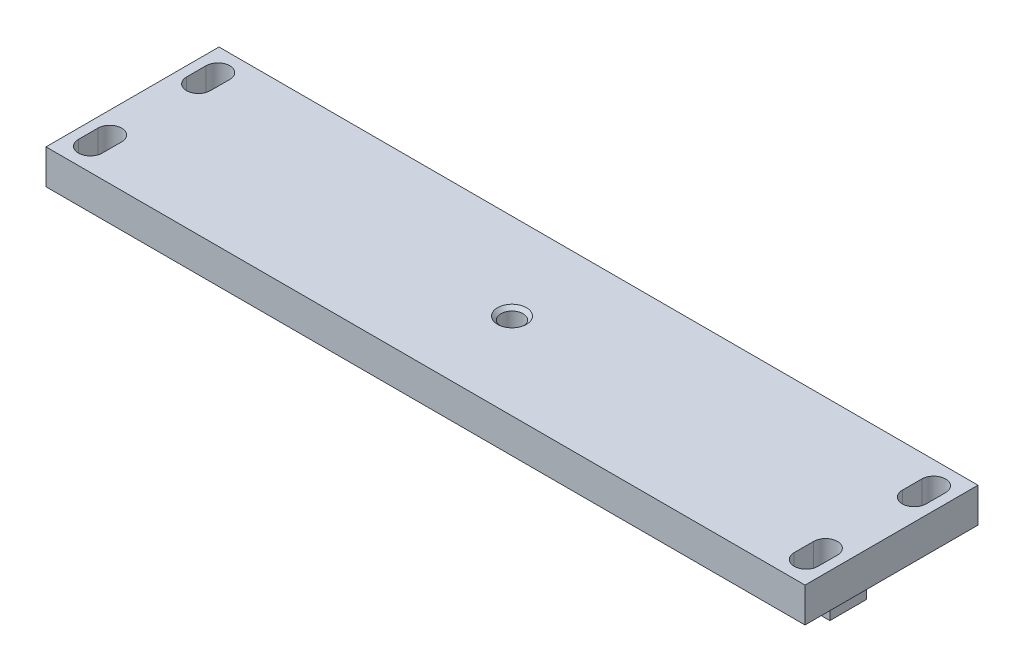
SolidWorks part; units mm, degrees
ref_plane "Спереди" through (0, 0, 0) normal (0, 0, 1) x (1, 0, 0)
ref_plane "Сверху" through (0, 0, 0) normal (0, 1, 0) x (1, 0, 0)
ref_plane "Справа" through (0, 0, 0) normal (1, 0, 0) x (0, 0, -1)
sketch "Эскиз1" plane through (0, 0, 0) normal (1, 0, 0) x (0, 0, -1)
  line L0 (0, 0) -> (0, 16)
  line L1 (0, 16) -> (80, 16)
  line L2 (80, 16) -> (80, 0)
  line L3 (80, 0) -> (48.5, 0)
  line L4 (48.5, 0) -> (48.5, -31)
  line L5 (48.5, -31) -> (31.5, -31)
  line L6 (31.5, -31) -> (31.5, 0)
  line L7 (31.5, 0) -> (0, 0)
  dimension "D1" = 80
  dimension "D2" = 16
  dimension "D3" = 16
  dimension "D4" = 17
  dimension "D5" = 47
extrude "Бобышка-Вытянуть1" add sketch "Эскиз1" along normal blind 351
sketch "Эскиз2" plane through (0, 0, -31.5) normal (0, 0, 1) x (1, 0, 0)
  line L10 (351, 0) -> (331, 0)
  line L11 (351, 0) -> (0, 0) construction
  line L12 (331, 0) -> (331, -24)
  line L13 (331, -24) -> (251, -24)
  line L14 (251, -24) -> (251, -31)
  line L15 (351, -31) -> (0, -31) construction
  line L16 (251, -31) -> (351, -31)
  line L17 (351, -31) -> (351, 0)
  line L18 (175.5, 16) -> (175.5, -31) construction
  line L19 (351, 16) -> (0, 16) construction
  line L26 (0, -31) -> (0, 0)
  line L27 (0, 0) -> (20, 0)
  line L28 (20, 0) -> (20, -24)
  line L29 (20, -24) -> (101, -24)
  line L30 (101, -24) -> (101, -31)
  line L31 (101, -31) -> (0, -31)
  dimension "D1" = 24
  dimension "D2" = 20
  dimension "D3" = 80
  dimension "D4" = 20
  dimension "D5" = 24
  dimension "D6" = 81
extrude "Вырез-Вытянуть1" cut sketch "Эскиз2" against normal through all
sketch "Эскиз3" plane through (0, 16, 0) normal (0, 1, 0) x (1, 0, 0)
  line L0 (10, 69.5) -> (10, 60.5) construction
  line L1 (15.5, 69.5) -> (15.5, 60.5)
  line L2 (4.5, 69.5) -> (4.5, 60.5)
  line L3 (10, 19.5) -> (10, 10.5) construction
  line L4 (15.5, 19.5) -> (15.5, 10.5)
  line L5 (4.5, 19.5) -> (4.5, 10.5)
  line L6 (341, 69.5) -> (341, 60.5) construction
  line L7 (346.5, 69.5) -> (346.5, 60.5)
  line L8 (335.5, 69.5) -> (335.5, 60.5)
  line L9 (341, 19.5) -> (341, 10.5) construction
  line L10 (346.5, 19.5) -> (346.5, 10.5)
  line L11 (335.5, 19.5) -> (335.5, 10.5)
  line L12 (0, 40) -> (351, 40) construction
  line L13 (0, 80) -> (0, 0) construction
  line L14 (351, 80) -> (351, 0) construction
  line L15 (175.5, 80) -> (175.5, 0) construction
  line L16 (351, 80) -> (0, 80) construction
  line L17 (351, 0) -> (0, 0) construction
  arc A0 (15.5, 69.5) -> (4.5, 69.5) centre (10, 69.5) ccw
  arc A1 (4.5, 60.5) -> (15.5, 60.5) centre (10, 60.5) ccw
  arc A2 (15.5, 19.5) -> (4.5, 19.5) centre (10, 19.5) ccw
  arc A3 (4.5, 10.5) -> (15.5, 10.5) centre (10, 10.5) ccw
  arc A4 (346.5, 69.5) -> (335.5, 69.5) centre (341, 69.5) ccw
  arc A5 (335.5, 60.5) -> (346.5, 60.5) centre (341, 60.5) ccw
  arc A6 (346.5, 19.5) -> (335.5, 19.5) centre (341, 19.5) ccw
  arc A7 (335.5, 10.5) -> (346.5, 10.5) centre (341, 10.5) ccw
  point P2 (10, 65)
  point P7 (10, 15)
  point P14 (341, 65)
  point P21 (341, 15)
  dimension "D1" = 20
  dimension "D2" = 20
  dimension "D3" = 20
  dimension "D4" = 20
  dimension "D5" = 5.5
  dimension "D6" = 5.5
  dimension "D7" = 5.5
  dimension "D8" = 5.5
  dimension "D12" = 5
  dimension "D13" = 30
  dimension "D14" = 5
  dimension "D15" = 30
  dimension "D9" = 10
  dimension "D10" = 10
  dimension "D11" = 10
extrude "Вырез-Вытянуть2" cut sketch "Эскиз3" against normal through all
sketch "Эскиз4" plane through (0, 0, -31.5) normal (0, 0, 1) x (1, 0, 0)
  line L0 (128, -20) -> (134, -20) construction
  line L1 (128, -15) -> (134, -15)
  line L2 (128, -25) -> (134, -25)
  line L3 (251, -24) -> (251, -31) construction
  line L4 (251, -31) -> (101, -31) construction
  circle A0 centre (221, -20) radius 5
  arc A1 (128, -15) -> (128, -25) centre (128, -20) ccw
  arc A2 (134, -25) -> (134, -15) centre (134, -20) ccw
  point P4 (131, -20)
  dimension "D1" = 10
  dimension "D2" = 5
  dimension "D3" = 16
  dimension "D4" = 90
  dimension "D5" = 30
  dimension "D6" = 11
extrude "Вырез-Вытянуть3" cut sketch "Эскиз4" against normal through all
hole_wizard "Отверстие обработанное метчиком M121" positions "Эскиз5" profile "Эскиз6" tap size "M12" standard "ISO"
sketch "Эскиз5" plane through (0, 16, 0) normal (0, 1, 0) x (1, 0, 0)
  line L0 (175.5, 80) -> (175.5, 0) construction
  line L1 (351, 80) -> (0, 80) construction
  line L2 (351, 0) -> (0, 0) construction
  line L4 (0, 40) -> (351, 40) construction
  line L5 (0, 80) -> (0, 0) construction
  line L6 (351, 80) -> (351, 0) construction
  point P0 (175.5, 40)
sketch "Эскиз6" plane through (175.5, 16, -40) normal (1, 0, 0) x (0, 0, 1)
  line L0 (0, 0) -> (0, 30.0644)
  line L1 (0, 30.0644) -> (5.1, 27)
  line L2 (5.1, 27) -> (5.1, 0)
  line L5 (5.1, 0) -> (0, 0)
  line L10 (0, 30.0644) -> (-5.1, 27) construction
  line L11 (0, -6.35) -> (0, 107.95) construction
  dimension "Диаметр сверла" = 10.2
  dimension "Глубина сверла" = 27
  dimension "Угол заточки сверла" = 118
chamfer "Фаска1" distance 1.6 angle 45 1 edges at (175.5, 16, -34.9)
hole_wizard "Отверстие обработанное метчиком M101" positions "Эскиз7" profile "Эскиз8" tap size "M10" standard "ISO"
sketch "Эскиз7" plane through (331, 0, 0) normal (1, 0, 0) x (0, 0, -1)
  line L0 (40, 0) -> (40, -24) construction
  line L1 (0, 0) -> (80, 0) construction
  line L2 (48.5, -24) -> (31.5, -24) construction
  point P0 (40, -14)
  dimension "D1" = 10
sketch "Эскиз8" plane through (331, -14, -40) normal (0, 1, 0) x (0, 0, -1)
  line L0 (0, 0) -> (0, 28.5537)
  line L1 (0, 28.5537) -> (4.25, 26)
  line L2 (4.25, 26) -> (4.25, 0)
  line L5 (4.25, 0) -> (0, 0)
  line L10 (0, 28.5537) -> (-4.25, 26) construction
  line L11 (0, -6.35) -> (0, 107.95) construction
  dimension "Диаметр сверла" = 8.5
  dimension "Глубина сверла" = 26
  dimension "Угол заточки сверла" = 118
chamfer "Фаска2" distance 1.5 angle 45 1 edges at (331, -14, -44.25)
hole_wizard "Отверстие обработанное метчиком M102" positions "Эскиз9" profile "Эскиз10" tap size "M10" standard "ISO"
sketch "Эскиз9" plane through (20, 0, 0) normal (-1, 0, 0) x (0, 0, 1)
  line L0 (-40, 0) -> (-40, -24) construction
  line L1 (-48.5, 0) -> (-31.5, 0) construction
  line L2 (-48.5, -24) -> (-31.5, -24) construction
  point P0 (-40, -14)
  dimension "D1" = 10
sketch "Эскиз10" plane through (20, -14, -40) normal (0, 1, 0) x (0, 0, 1)
  line L0 (0, 0) -> (0, 28.5537)
  line L1 (0, 28.5537) -> (4.25, 26)
  line L2 (4.25, 26) -> (4.25, 0)
  line L5 (4.25, 0) -> (0, 0)
  line L10 (0, 28.5537) -> (-4.25, 26) construction
  line L11 (0, -6.35) -> (0, 107.95) construction
  dimension "Диаметр сверла" = 8.5
  dimension "Глубина сверла" = 26
  dimension "Угол заточки сверла" = 118
chamfer "Фаска3" distance 1.5 angle 45 1 edges at (20, -14, -35.75)
chamfer "Фаска4" distance 1 angle 45 10 edges at (131, -15, -48.5) (123, -20, -48.5) (139, -20, -48.5) (131, -25, -48.5) (226, -20, -48.5) (226, -20, -31.5) (131, -25, -31.5) (139, -20, -31.5) (123, -20, -31.5) (131, -15, -31.5)
